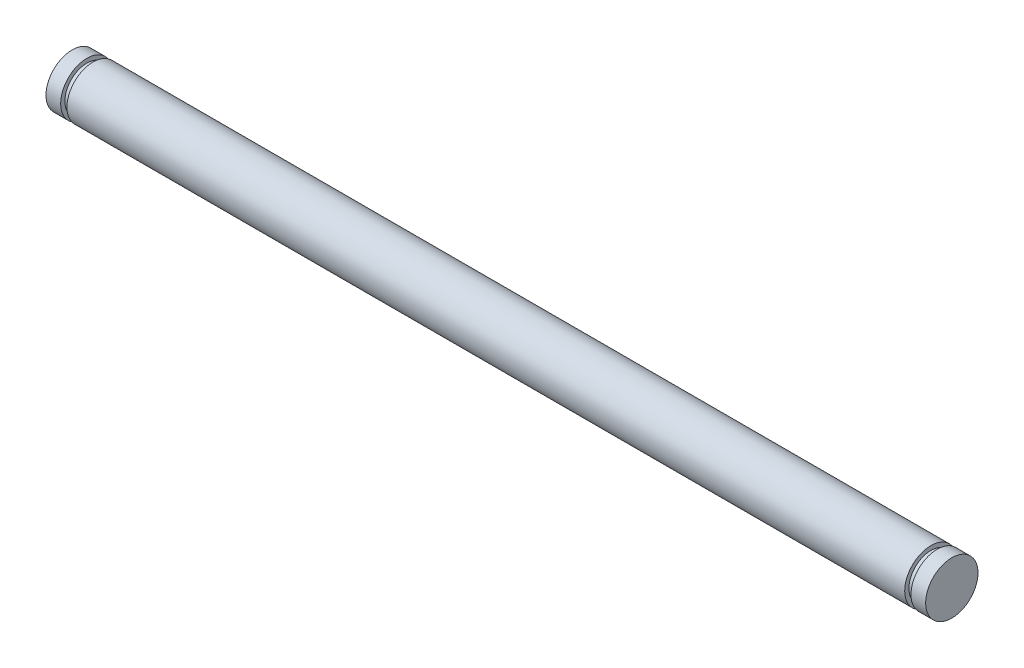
SolidWorks part; units mm, degrees
ref_plane "Front Plane" through (0, 0, 0) normal (0, 0, 1) x (1, 0, 0)
ref_plane "Top Plane" through (0, 0, 0) normal (0, 1, 0) x (1, 0, 0)
ref_plane "Right Plane" through (0, 0, 0) normal (1, 0, 0) x (0, 0, -1)
sketch "Sketch1" plane through (0, 0, 0) normal (1, 0, 0) x (0, 0, -1)
  circle A0 centre (0, 0) radius 3.175
  dimension "D1" = 6.35
extrude "Boss-Extrude1" add sketch "Sketch1" along normal mid plane 106.68
sketch "Sketch2" plane through (0, 0, 0) normal (0, 1, 0) x (1, 0, 0)
  line L0 (53.34, 3.175) -> (-53.34, 3.175) construction
  line L1 (-51.562, 3.175) -> (-50.8, 3.175)
  line L2 (-51.562, 3.175) -> (-51.562, 2.667)
  line L3 (-51.562, 2.667) -> (-50.8, 2.667)
  line L4 (-50.8, 3.175) -> (-50.8, 2.667)
  line L5 (-53.34, 0) -> (0, 0) construction
  line L6 (-53.34, 3.175) -> (-53.34, -3.175) construction
  line L7 (0, 0) -> (0, 3.175) construction
  line L8 (50.8, 3.175) -> (50.8, 2.667)
  line L9 (51.562, 2.667) -> (50.8, 2.667)
  line L10 (51.562, 3.175) -> (51.562, 2.667)
  line L11 (51.562, 3.175) -> (50.8, 3.175)
  dimension "D1" = 2.667
  dimension "D2" = 0.762
  dimension "D3" = 50.8
revolve "Cut-Revolve1" cut sketch "Sketch2" angle 360 about L5
